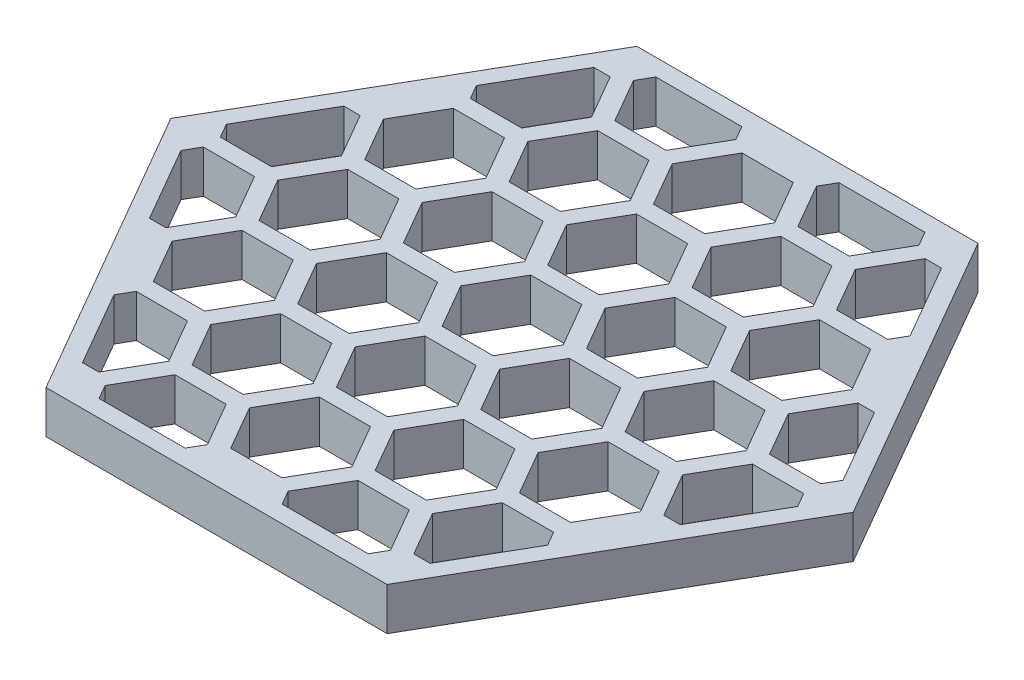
SolidWorks part; units mm, degrees
ref_plane "Alzado" through (0, 0, 0) normal (0, 0, 1) x (1, 0, 0)
ref_plane "Planta" through (0, 0, 0) normal (0, 1, 0) x (1, 0, 0)
ref_plane "Vista lateral" through (0, 0, 0) normal (1, 0, 0) x (0, 0, -1)
sketch "Croquis1" plane through (0, 0, 0) normal (0, 1, 0) x (1, 0, 0)
  line L0 (0, 0) -> (40, 0) construction
  line L1 (40, 0) -> (20, 34.641)
  line L2 (20, 34.641) -> (-20, 34.641)
  line L3 (-20, 34.641) -> (-40, 0)
  line L4 (-40, 0) -> (-20, -34.641)
  line L5 (-20, -34.641) -> (20, -34.641)
  line L6 (20, -34.641) -> (40, 0)
  line L7 (0, 0) -> (30, 17.3205) construction
  line L8 (6, 0) -> (3, 5.1962)
  line L9 (3, 5.1962) -> (-3, 5.1962)
  line L10 (-3, 5.1962) -> (-6, 0)
  line L11 (-6, 0) -> (-3, -5.1962)
  line L12 (-3, -5.1962) -> (3, -5.1962)
  line L13 (3, -5.1962) -> (6, 0)
  line L14 (3, 5.1962) -> (4.7321, 6.1962) construction
  line L15 (16.7321, 6.1962) -> (13.7321, 11.3923)
  line L16 (13.7321, 11.3923) -> (7.7321, 11.3923)
  line L17 (7.7321, 11.3923) -> (4.7321, 6.1962)
  line L18 (4.7321, 6.1962) -> (7.7321, 1)
  line L19 (7.7321, 1) -> (13.7321, 1)
  line L20 (13.7321, 1) -> (16.7321, 6.1962)
  line L21 (27.4641, 12.3923) -> (24.4641, 17.5885)
  line L22 (24.4641, 17.5885) -> (18.4641, 17.5885)
  line L23 (18.4641, 17.5885) -> (15.4641, 12.3923)
  line L24 (15.4641, 12.3923) -> (18.4641, 7.1962)
  line L25 (18.4641, 7.1962) -> (24.4641, 7.1962)
  line L26 (24.4641, 7.1962) -> (27.4641, 12.3923)
  line L27 (13.7321, 11.3923) -> (15.4641, 12.3923) construction
  line L28 (0, 0) -> (0, 34.641) construction
  line L29 (-3, 7.1962) -> (-3, 5.1962) construction
  line L30 (3, 17.5885) -> (-3, 17.5885)
  line L31 (-3, 17.5885) -> (-6, 12.3923)
  line L32 (-6, 12.3923) -> (-3, 7.1962)
  line L33 (-3, 7.1962) -> (3, 7.1962)
  line L34 (3, 7.1962) -> (6, 12.3923)
  line L35 (6, 12.3923) -> (3, 17.5885)
  line L36 (6, 24.7846) -> (3, 29.9808)
  line L37 (3, 29.9808) -> (-3, 29.9808)
  line L38 (-3, 29.9808) -> (-6, 24.7846)
  line L39 (-6, 24.7846) -> (-3, 19.5885)
  line L40 (-3, 19.5885) -> (3, 19.5885)
  line L41 (3, 19.5885) -> (6, 24.7846)
  line L42 (6, 37.1769) -> (3, 42.3731)
  line L43 (3, 42.3731) -> (-3, 42.3731)
  line L44 (-3, 42.3731) -> (-6, 37.1769)
  line L45 (-6, 37.1769) -> (-3, 31.9808)
  line L46 (-3, 31.9808) -> (3, 31.9808)
  line L47 (3, 31.9808) -> (6, 37.1769)
  line L48 (-3, 19.5885) -> (-3, 17.5885) construction
  line L49 (-3, 31.9808) -> (-3, 29.9808) construction
  line L50 (0, 12.3923) -> (24.634, 26.6147) construction
  line L51 (16.7321, 18.5885) -> (13.7321, 23.7846)
  line L52 (13.7321, 23.7846) -> (7.7321, 23.7846)
  line L53 (7.7321, 23.7846) -> (4.7321, 18.5885)
  line L54 (4.7321, 18.5885) -> (7.7321, 13.3923)
  line L55 (7.7321, 13.3923) -> (13.7321, 13.3923)
  line L56 (13.7321, 13.3923) -> (16.7321, 18.5885)
  line L57 (16.7321, 30.9808) -> (13.7321, 36.1769)
  line L58 (13.7321, 36.1769) -> (7.7321, 36.1769)
  line L59 (7.7321, 36.1769) -> (4.7321, 30.9808)
  line L60 (4.7321, 30.9808) -> (7.7321, 25.7846)
  line L61 (7.7321, 25.7846) -> (13.7321, 25.7846)
  line L62 (13.7321, 25.7846) -> (16.7321, 30.9808)
  line L63 (27.4641, 24.7846) -> (24.4641, 29.9808)
  line L64 (24.4641, 29.9808) -> (18.4641, 29.9808)
  line L65 (18.4641, 29.9808) -> (15.4641, 24.7846)
  line L66 (15.4641, 24.7846) -> (18.4641, 19.5885)
  line L67 (18.4641, 19.5885) -> (24.4641, 19.5885)
  line L68 (24.4641, 19.5885) -> (27.4641, 24.7846)
  line L69 (10.7321, 6.1962) -> (10.7321, 34.641) construction
  line L70 (0, 24.7846) -> (17.0718, 34.641) construction
  line L71 (21.4641, 12.3923) -> (21.4641, 32.1051) construction
  line L72 (13.7321, -11.3923) -> (16.7321, -6.1962)
  line L73 (16.7321, -6.1962) -> (13.7321, -1)
  line L74 (13.7321, -1) -> (7.7321, -1)
  line L75 (7.7321, -1) -> (4.7321, -6.1962)
  line L76 (4.7321, -6.1962) -> (7.7321, -11.3923)
  line L77 (7.7321, -11.3923) -> (13.7321, -11.3923)
  line L78 (24.4641, -17.5885) -> (27.4641, -12.3923)
  line L79 (27.4641, -12.3923) -> (24.4641, -7.1962)
  line L80 (24.4641, -7.1962) -> (18.4641, -7.1962)
  line L81 (18.4641, -7.1962) -> (15.4641, -12.3923)
  line L82 (15.4641, -12.3923) -> (18.4641, -17.5885)
  line L83 (18.4641, -17.5885) -> (24.4641, -17.5885)
  line L84 (24.4641, -5.1962) -> (27.4641, 0)
  line L85 (27.4641, 0) -> (24.4641, 5.1962)
  line L86 (24.4641, 5.1962) -> (18.4641, 5.1962)
  line L87 (18.4641, 5.1962) -> (15.4641, 0)
  line L88 (15.4641, 0) -> (18.4641, -5.1962)
  line L89 (18.4641, -5.1962) -> (24.4641, -5.1962)
  line L90 (35.1962, -11.3923) -> (38.1962, -6.1962)
  line L91 (38.1962, -6.1962) -> (35.1962, -1)
  line L92 (35.1962, -1) -> (29.1962, -1)
  line L93 (29.1962, -1) -> (26.1962, -6.1962)
  line L94 (26.1962, -6.1962) -> (29.1962, -11.3923)
  line L95 (29.1962, -11.3923) -> (35.1962, -11.3923)
  line L96 (35.1962, 1) -> (38.1962, 6.1962)
  line L97 (38.1962, 6.1962) -> (35.1962, 11.3923)
  line L98 (35.1962, 11.3923) -> (29.1962, 11.3923)
  line L99 (29.1962, 11.3923) -> (26.1962, 6.1962)
  line L100 (26.1962, 6.1962) -> (29.1962, 1)
  line L101 (29.1962, 1) -> (35.1962, 1)
  line L102 (35.1962, 13.3923) -> (38.1962, 18.5885)
  line L103 (38.1962, 18.5885) -> (35.1962, 23.7846)
  line L104 (35.1962, 23.7846) -> (29.1962, 23.7846)
  line L105 (29.1962, 23.7846) -> (26.1962, 18.5885)
  line L106 (26.1962, 18.5885) -> (29.1962, 13.3923)
  line L107 (29.1962, 13.3923) -> (35.1962, 13.3923)
  line L108 (-3, -17.5885) -> (3, -17.5885)
  line L109 (3, -17.5885) -> (6, -12.3923)
  line L110 (6, -12.3923) -> (3, -7.1962)
  line L111 (3, -7.1962) -> (-3, -7.1962)
  line L112 (-3, -7.1962) -> (-6, -12.3923)
  line L113 (-6, -12.3923) -> (-3, -17.5885)
  line L114 (-3, -29.9808) -> (3, -29.9808)
  line L115 (3, -29.9808) -> (6, -24.7846)
  line L116 (6, -24.7846) -> (3, -19.5885)
  line L117 (3, -19.5885) -> (-3, -19.5885)
  line L118 (-3, -19.5885) -> (-6, -24.7846)
  line L119 (-6, -24.7846) -> (-3, -29.9808)
  line L120 (7.7321, -23.7846) -> (13.7321, -23.7846)
  line L121 (13.7321, -23.7846) -> (16.7321, -18.5885)
  line L122 (16.7321, -18.5885) -> (13.7321, -13.3923)
  line L123 (13.7321, -13.3923) -> (7.7321, -13.3923)
  line L124 (7.7321, -13.3923) -> (4.7321, -18.5885)
  line L125 (4.7321, -18.5885) -> (7.7321, -23.7846)
  line L126 (7.7321, -36.1769) -> (13.7321, -36.1769)
  line L127 (13.7321, -36.1769) -> (16.7321, -30.9808)
  line L128 (16.7321, -30.9808) -> (13.7321, -25.7846)
  line L129 (13.7321, -25.7846) -> (7.7321, -25.7846)
  line L130 (7.7321, -25.7846) -> (4.7321, -30.9808)
  line L131 (4.7321, -30.9808) -> (7.7321, -36.1769)
  line L132 (18.4641, -29.9808) -> (24.4641, -29.9808)
  line L133 (24.4641, -29.9808) -> (27.4641, -24.7846)
  line L134 (27.4641, -24.7846) -> (24.4641, -19.5885)
  line L135 (24.4641, -19.5885) -> (18.4641, -19.5885)
  line L136 (18.4641, -19.5885) -> (15.4641, -24.7846)
  line L137 (15.4641, -24.7846) -> (18.4641, -29.9808)
  line L138 (29.1962, -23.7846) -> (35.1962, -23.7846)
  line L139 (35.1962, -23.7846) -> (38.1962, -18.5885)
  line L140 (38.1962, -18.5885) -> (35.1962, -13.3923)
  line L141 (35.1962, -13.3923) -> (29.1962, -13.3923)
  line L142 (29.1962, -13.3923) -> (26.1962, -18.5885)
  line L143 (26.1962, -18.5885) -> (29.1962, -23.7846)
  line L144 (-16.7321, -6.1962) -> (-13.7321, -11.3923)
  line L145 (-13.7321, -11.3923) -> (-7.7321, -11.3923)
  line L146 (-7.7321, -11.3923) -> (-4.7321, -6.1962)
  line L147 (-4.7321, -6.1962) -> (-7.7321, -1)
  line L148 (-7.7321, -1) -> (-13.7321, -1)
  line L149 (-13.7321, -1) -> (-16.7321, -6.1962)
  line L150 (-27.4641, -12.3923) -> (-24.4641, -17.5885)
  line L151 (-24.4641, -17.5885) -> (-18.4641, -17.5885)
  line L152 (-18.4641, -17.5885) -> (-15.4641, -12.3923)
  line L153 (-15.4641, -12.3923) -> (-18.4641, -7.1962)
  line L154 (-18.4641, -7.1962) -> (-24.4641, -7.1962)
  line L155 (-24.4641, -7.1962) -> (-27.4641, -12.3923)
  line L156 (-16.7321, -18.5885) -> (-13.7321, -23.7846)
  line L157 (-13.7321, -23.7846) -> (-7.7321, -23.7846)
  line L158 (-7.7321, -23.7846) -> (-4.7321, -18.5885)
  line L159 (-4.7321, -18.5885) -> (-7.7321, -13.3923)
  line L160 (-7.7321, -13.3923) -> (-13.7321, -13.3923)
  line L161 (-13.7321, -13.3923) -> (-16.7321, -18.5885)
  line L162 (-27.4641, -24.7846) -> (-24.4641, -29.9808)
  line L163 (-24.4641, -29.9808) -> (-18.4641, -29.9808)
  line L164 (-18.4641, -29.9808) -> (-15.4641, -24.7846)
  line L165 (-15.4641, -24.7846) -> (-18.4641, -19.5885)
  line L166 (-18.4641, -19.5885) -> (-24.4641, -19.5885)
  line L167 (-24.4641, -19.5885) -> (-27.4641, -24.7846)
  line L168 (-16.7321, -30.9808) -> (-13.7321, -36.1769)
  line L169 (-13.7321, -36.1769) -> (-7.7321, -36.1769)
  line L170 (-7.7321, -36.1769) -> (-4.7321, -30.9808)
  line L171 (-4.7321, -30.9808) -> (-7.7321, -25.7846)
  line L172 (-7.7321, -25.7846) -> (-13.7321, -25.7846)
  line L173 (-13.7321, -25.7846) -> (-16.7321, -30.9808)
  line L174 (-6, -37.1769) -> (-3, -42.3731)
  line L175 (-3, -42.3731) -> (3, -42.3731)
  line L176 (3, -42.3731) -> (6, -37.1769)
  line L177 (6, -37.1769) -> (3, -31.9808)
  line L178 (3, -31.9808) -> (-3, -31.9808)
  line L179 (-3, -31.9808) -> (-6, -37.1769)
  line L180 (-13.7321, 11.3923) -> (-16.7321, 6.1962)
  line L181 (-16.7321, 6.1962) -> (-13.7321, 1)
  line L182 (-13.7321, 1) -> (-7.7321, 1)
  line L183 (-7.7321, 1) -> (-4.7321, 6.1962)
  line L184 (-4.7321, 6.1962) -> (-7.7321, 11.3923)
  line L185 (-7.7321, 11.3923) -> (-13.7321, 11.3923)
  line L186 (-24.4641, 17.5885) -> (-27.4641, 12.3923)
  line L187 (-27.4641, 12.3923) -> (-24.4641, 7.1962)
  line L188 (-24.4641, 7.1962) -> (-18.4641, 7.1962)
  line L189 (-18.4641, 7.1962) -> (-15.4641, 12.3923)
  line L190 (-15.4641, 12.3923) -> (-18.4641, 17.5885)
  line L191 (-18.4641, 17.5885) -> (-24.4641, 17.5885)
  line L192 (-24.4641, 5.1962) -> (-27.4641, 0)
  line L193 (-27.4641, 0) -> (-24.4641, -5.1962)
  line L194 (-24.4641, -5.1962) -> (-18.4641, -5.1962)
  line L195 (-18.4641, -5.1962) -> (-15.4641, 0)
  line L196 (-15.4641, 0) -> (-18.4641, 5.1962)
  line L197 (-18.4641, 5.1962) -> (-24.4641, 5.1962)
  line L198 (-35.1962, 11.3923) -> (-38.1962, 6.1962)
  line L199 (-38.1962, 6.1962) -> (-35.1962, 1)
  line L200 (-35.1962, 1) -> (-29.1962, 1)
  line L201 (-29.1962, 1) -> (-26.1962, 6.1962)
  line L202 (-26.1962, 6.1962) -> (-29.1962, 11.3923)
  line L203 (-29.1962, 11.3923) -> (-35.1962, 11.3923)
  line L204 (-35.1962, -1) -> (-38.1962, -6.1962)
  line L205 (-38.1962, -6.1962) -> (-35.1962, -11.3923)
  line L206 (-35.1962, -11.3923) -> (-29.1962, -11.3923)
  line L207 (-29.1962, -11.3923) -> (-26.1962, -6.1962)
  line L208 (-26.1962, -6.1962) -> (-29.1962, -1)
  line L209 (-29.1962, -1) -> (-35.1962, -1)
  line L210 (-35.1962, -13.3923) -> (-38.1962, -18.5885)
  line L211 (-38.1962, -18.5885) -> (-35.1962, -23.7846)
  line L212 (-35.1962, -23.7846) -> (-29.1962, -23.7846)
  line L213 (-29.1962, -23.7846) -> (-26.1962, -18.5885)
  line L214 (-26.1962, -18.5885) -> (-29.1962, -13.3923)
  line L215 (-29.1962, -13.3923) -> (-35.1962, -13.3923)
  line L216 (3, 17.5885) -> (-3, 17.5885)
  line L217 (-3, 17.5885) -> (-6, 12.3923)
  line L218 (-6, 12.3923) -> (-3, 7.1962)
  line L219 (-3, 7.1962) -> (3, 7.1962)
  line L220 (3, 7.1962) -> (6, 12.3923)
  line L221 (6, 12.3923) -> (3, 17.5885)
  line L222 (3, 29.9808) -> (-3, 29.9808)
  line L223 (-3, 29.9808) -> (-6, 24.7846)
  line L224 (-6, 24.7846) -> (-3, 19.5885)
  line L225 (-3, 19.5885) -> (3, 19.5885)
  line L226 (3, 19.5885) -> (6, 24.7846)
  line L227 (6, 24.7846) -> (3, 29.9808)
  line L228 (-7.7321, 23.7846) -> (-13.7321, 23.7846)
  line L229 (-13.7321, 23.7846) -> (-16.7321, 18.5885)
  line L230 (-16.7321, 18.5885) -> (-13.7321, 13.3923)
  line L231 (-13.7321, 13.3923) -> (-7.7321, 13.3923)
  line L232 (-7.7321, 13.3923) -> (-4.7321, 18.5885)
  line L233 (-4.7321, 18.5885) -> (-7.7321, 23.7846)
  line L234 (-7.7321, 36.1769) -> (-13.7321, 36.1769)
  line L235 (-13.7321, 36.1769) -> (-16.7321, 30.9808)
  line L236 (-16.7321, 30.9808) -> (-13.7321, 25.7846)
  line L237 (-13.7321, 25.7846) -> (-7.7321, 25.7846)
  line L238 (-7.7321, 25.7846) -> (-4.7321, 30.9808)
  line L239 (-4.7321, 30.9808) -> (-7.7321, 36.1769)
  line L240 (-18.4641, 29.9808) -> (-24.4641, 29.9808)
  line L241 (-24.4641, 29.9808) -> (-27.4641, 24.7846)
  line L242 (-27.4641, 24.7846) -> (-24.4641, 19.5885)
  line L243 (-24.4641, 19.5885) -> (-18.4641, 19.5885)
  line L244 (-18.4641, 19.5885) -> (-15.4641, 24.7846)
  line L245 (-15.4641, 24.7846) -> (-18.4641, 29.9808)
  line L246 (-29.1962, 23.7846) -> (-35.1962, 23.7846)
  line L247 (-35.1962, 23.7846) -> (-38.1962, 18.5885)
  line L248 (-38.1962, 18.5885) -> (-35.1962, 13.3923)
  line L249 (-35.1962, 13.3923) -> (-29.1962, 13.3923)
  line L250 (-29.1962, 13.3923) -> (-26.1962, 18.5885)
  line L251 (-26.1962, 18.5885) -> (-29.1962, 23.7846)
  line L252 (-28.2679, 16.3205) -> (-30, 17.3205) construction
  line L259 (37.6906, 0) -> (18.8453, 32.641)
  line L260 (18.8453, 32.641) -> (-18.8453, 32.641)
  line L261 (-18.8453, 32.641) -> (-37.6906, 0)
  line L262 (-37.6906, 0) -> (-18.8453, -32.641)
  line L263 (-18.8453, -32.641) -> (18.8453, -32.641)
  line L264 (18.8453, -32.641) -> (37.6906, 0)
  circle A0 centre (0, 0) radius 34.641 construction
  circle A1 centre (0, 0) radius 5.1962 construction
  circle A2 centre (10.7321, 6.1962) radius 5.1962 construction
  circle A3 centre (21.4641, 12.3923) radius 5.1962 construction
  circle A4 centre (0, 12.3923) radius 5.1962 construction
  circle A5 centre (0, 24.7846) radius 5.1962 construction
  circle A6 centre (0, 37.1769) radius 5.1962 construction
  circle A7 centre (10.7321, 18.5885) radius 5.1962 construction
  circle A8 centre (10.7321, 30.9808) radius 5.1962 construction
  circle A9 centre (21.4641, 24.7846) radius 5.1962 construction
  circle A10 centre (0, 0) radius 34.641 construction
  circle A11 centre (0, 0) radius 34.641 construction
  circle A12 centre (0, 0) radius 34.641 construction
  circle A13 centre (0, 0) radius 34.641 construction
  circle A14 centre (0, 0) radius 34.641 construction
  circle A15 centre (0, 0) radius 32.641 construction
  dimension "D1" = 80
  dimension "D2" = 12
  dimension "D3" = 2
  dimension "D5" = 2
  dimension "D4" = 6
extrude "Saliente-Extruir1" add sketch "Croquis1" along normal blind 5 contours L263 L264 L132 L137 L136 L135 L134 L143 L142 L141 L95 L94 L93 L92 L91 L259 L96 L101 L100 L99 L98 L107 L106 L105 L68 L67 L66 L65 L64 L260 L57 L62 L61 L60 L59 L47 L46 L45 L239 L238 L237 L236 L235 | L263 L262 L163 L4 L5 L168 | L263 L168 L5 L170 | L263 L170 L5 L179 | L263 L179 L5 L177 | L263 L177 L5 L131 | L263 L131 L5 L127 | L264 L263 L127 L5 L6 L132 | L264 L132 L6 L134 | L264 L134 L6 L143 | L264 L143 L6 L141 | L264 L141 L6 L95 | L264 L95 L6 L91 | L264 L91 L6 L1 L96 L259 | L262 L167 L4 L163 | L262 L213 L4 L167 | L262 L215 L4 L213 | L262 L261 L199 L3 L4 L204 | L262 L204 L4 L206 | L262 L206 L4 L215 | L215 L262 L213 L214 | L179 L263 L177 L178 | L143 L264 L141 L142 | L259 L96 L1 L98 | L259 L98 L1 L107 | L259 L107 L1 L105 | L107 L259 L105 L106 | L259 L105 L1 L68 | L259 L68 L1 L64 | L260 L259 L64 L1 L2 L57 | L260 L57 L2 L59 | L260 L59 L2 L47 | L260 L47 L2 L45 | L260 L45 L2 L239 | L260 L239 L2 L235 | L261 L260 L235 L2 L3 L240 | L261 L240 L3 L242 | L261 L242 L3 L251 | L261 L251 L3 L249 | L261 L249 L3 L203 | L261 L203 L3 L199 | L251 L261 L249 L250 | L47 L260 L45 L46
